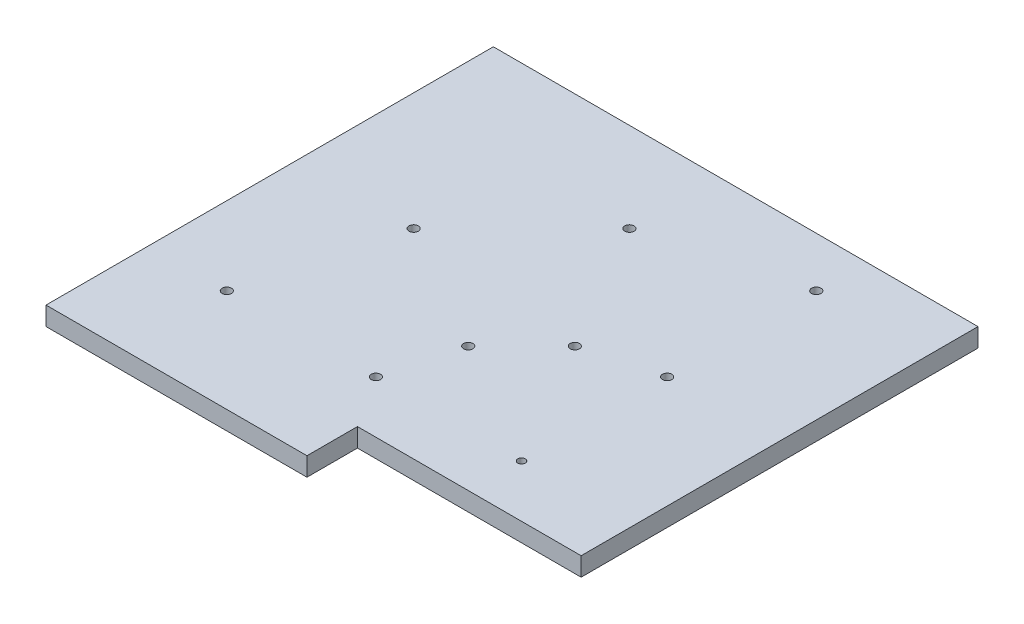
SolidWorks part; units mm, degrees
ref_plane "Front Plane" through (0, 0, 0) normal (0, 0, 1) x (1, 0, 0)
ref_plane "Top Plane" through (0, 0, 0) normal (0, 1, 0) x (1, 0, 0)
ref_plane "Right Plane" through (0, 0, 0) normal (1, 0, 0) x (0, 0, -1)
sketch "Sketch1" plane through (0, 0, 0) normal (0, 1, 0) x (1, 0, 0)
  line L0 (0, 0) -> (330.2, 0)
  line L1 (0, 0) -> (0, 304.8)
  line L2 (330.2, 0) -> (330.2, 304.8)
  line L3 (0, 304.8) -> (330.2, 304.8)
  dimension "D1" = 304.8
  dimension "D2" = 330.2
extrude "Boss-Extrude1" add sketch "Sketch1" along normal blind 12.7
sketch "Sketch2" plane through (0, 12.7, 0) normal (0, 1, 0) x (1, 0, 0)
  line L0 (177.8, 0) -> (330.2, 0)
  line L1 (177.8, 0) -> (177.8, 34.4)
  line L2 (330.2, 0) -> (330.2, 34.4)
  line L3 (177.8, 34.4) -> (330.2, 34.4)
  line L4 (0, 0) -> (330.2, 0) construction
  dimension "D1" = 152.4
  dimension "D2" = 34.4
extrude "Cut-Extrude1" cut sketch "Sketch2" against normal blind 12.7
hole_wizard "#7 (0.201) Diameter Hole1" positions "Sketch4" profile "Sketch3" hole size "#7" standard "ANSI Inch"
sketch "Sketch4" plane through (0, 12.7, 0) normal (0, 1, 0) x (1, 0, 0)
  line L0 (330.2, 34.4) -> (330.2, 304.8) construction
  line L1 (330.2, 34.4) -> (177.8, 34.4) construction
  point P0 (254, 70)
  dimension "D1" = 76.2
  dimension "D2" = 35.6
sketch "Sketch3" plane through (254, 12.7, -70) normal (1, 0, 0) x (0, 0, 1)
  line L0 (0, 0) -> (0, 52.3338)
  line L1 (0, 52.3338) -> (2.5527, 50.8)
  line L2 (2.5527, 50.8) -> (2.5527, 0)
  line L5 (2.5527, 0) -> (0, 0)
  line L10 (0, 52.3338) -> (-2.5527, 50.8) construction
  line L11 (0, -6.35) -> (0, 107.95) construction
  dimension "Hole Dia." = 5.1054
  dimension "Hole Depth" = 50.8
  dimension "Drill Angle" = 118
hole_wizard "1/4 (0.25) Diameter Hole1" positions "Sketch6" profile "Sketch5" hole size "1/4" standard "ANSI Inch"
sketch "Sketch6" plane through (0, 12.7, 0) normal (0, 1, 0) x (1, 0, 0)
  line L0 (330.2, 34.4) -> (330.2, 304.8) construction
  circle A0 centre (254, 70) radius 2.5527 construction
  point P0 (254, 169.2)
  point P2 (254, 270.8)
  dimension "D1" = 76.2
  dimension "D2" = 76.2
  dimension "D3" = 99.2
  dimension "D4" = 200.8
sketch "Sketch5" plane through (254, 12.7, -169.2) normal (1, 0, 0) x (0, 0, 1)
  line L0 (0, 0) -> (0, 52.7077)
  line L1 (0, 52.7077) -> (3.175, 50.8)
  line L2 (3.175, 50.8) -> (3.175, 0)
  line L5 (3.175, 0) -> (0, 0)
  line L10 (0, 52.7077) -> (-3.175, 50.8) construction
  line L11 (0, -6.35) -> (0, 107.95) construction
  dimension "Hole Dia." = 6.35
  dimension "Hole Depth" = 50.8
  dimension "Drill Angle" = 118
pattern_circular "CirPattern1" count 4 over 90 about axis through (254, 0, -70) along (0, 1, 0) of "1/4 (0.25) Diameter Hole1"
